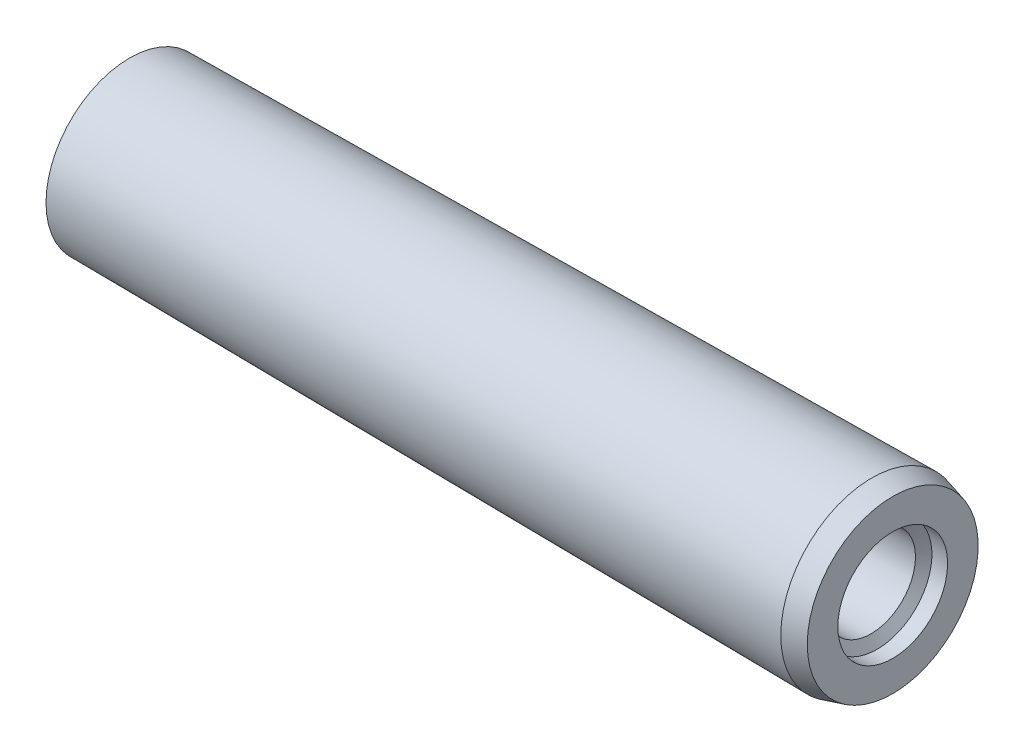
SolidWorks part; units mm, degrees
ref_plane "Plane1" through (0, 0, 0) normal (0, 0, 1) x (1, 0, 0)
ref_plane "Plane2" through (0, 0, 0) normal (0, 1, 0) x (1, 0, 0)
ref_plane "Plane3" through (0, 0, 0) normal (1, 0, 0) x (0, 0, -1)
sketch "BodySke" plane through (0, 0, 0) normal (0, 0, 1) x (1, 0, 0)
  line L0 (0, 0) -> (66, 0) construction
  line L1 (0, 0) -> (40, 0) construction
  line L2 (2, 8) -> (73, 8.71)
  line L3 (73, 8.71) -> (75, 8.1741)
  line L4 (0, 0) -> (48.2396, 0)
  line L5 (75, 8.1741) -> (75, 5.25)
  line L6 (75, 5.25) -> (73.5, 5.25)
  line L7 (73.5, 5.25) -> (72.9226, 4.25)
  line L8 (72.9226, 4.25) -> (50, 4.25)
  line L9 (50, 4.25) -> (48.2396, 0)
  line L10 (72, 7) -> (72, 3) construction
  line L11 (59, 16) -> (59, 0) construction
  arc A0 (2, 8) -> (0, 0) centre (17, 0) ccw
  dimension "D3" = 67.5
  dimension "D1" = 75
  dimension "Diameter" = 16
  dimension "D2" = 0.573
  dimension "Length" = 75
  dimension "Crown_ht" = 2
  dimension "Chamfer_len" = 2
  dimension "Cbore_dia" = 10.5
  dimension "Cbore_dep" = 1.5
  dimension "Tapdrill_dia" = 8.5
  dimension "Tapdrill_dep" = 25
  dimension "D4" = 30
  dimension "Advance" = 1.5
  dimension "Thread_dep" = 16
revolve "Body" add sketch "BodySke" angle 360 about L0
sketch "ThdSchSke" plane through (0, 0, 0) normal (0, 0, 1) x (1, 0, 0)
  line L0 (73.3557, 5) -> (73.9354, 4.172)
  line L2 (73.3557, 5) -> (72.7759, 4.172)
  line L3 (72.7759, 4.172) -> (73.9354, 4.172)
  line L4 (73.3557, 5.8566) -> (73.3557, 1.7596) construction
  line L5 (27, 0) -> (36, 0) construction
  line L6 (0, 0) -> (66, 0) construction
  line L7 (75, -8.1741) -> (75, 8.1741) construction
  dimension "D1" = 70
  dimension "Thread_nominal" = 10
  dimension "Inset" = 1.6443
  dimension "Thread_minor" = 8.344
revolve "ThreadSchematic" [suppressed] cut sketch "ThdSchSke" angle 360 about L5
pattern_linear "ThdSchPat" [suppressed]
equation "' \"Diameter@BodySke\" = 16"
equation "' \"Crown_ht@BodySke\" = 2"
equation "' \"Thread_major@ThreadCosmetic\"  = 10"
equation "' \"Advance@BodySke\" = 1.5"
equation "' \"Cbore_dia@BodySke\" = 10.5"
equation "' \"Thread_dep@BodySke\"  = 16"
equation "' \"Tapdrill_dep@BodySke\" = 25"
equation "' \"Cbore_dep@BodySke\" = 1.5"
equation "' \"Tapdrill_dia@BodySke\" = 8.5"
equation "' \"Thread_minor@ThdSchSke\" = 8.344"
equation "'  \"Length@BodySke\" = 75"
equation "\"Chamfer_len@BodySke\" = \"Crown_ht@BodySke\""
equation "\"Depth@ThreadCosmetic\" = \"Thread_dep@BodySke\"  -  \"Cbore_dep@BodySke\""
equation "\"Thread_nominal@ThdSchSke\" = \"Thread_major@ThreadCosmetic\""
equation "\"Inset@ThdSchSke\" = \"Cbore_dep@BodySke\" + (\"Cbore_dia@BodySke\" - \"Thread_major@ThreadCosmetic\") / 2 * tan(30 * 0.0174533)"
equation "\"Num_threads@ThdSchPat\" = int(  ( \"Thread_dep@BodySke\"  - \"Inset@ThdSchSke\" ) / \"Advance@BodySke\" + 0.999 )  + 1"
equation "\"Advance@ThdSchPat\" = (  \"Thread_dep@BodySke\" - \"Inset@ThdSchSke\" ) /  (\"Num_threads@ThdSchPat\" - 1) 'relax it"
